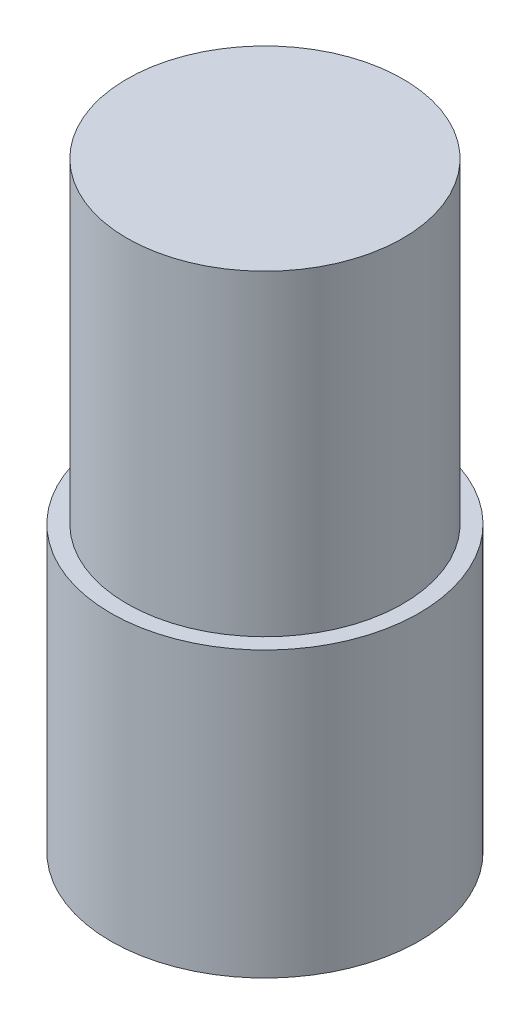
SolidWorks part; units mm, degrees
ref_plane "前视基准面" through (0, 0, 0) normal (0, 0, 1) x (1, 0, 0)
ref_plane "上视基准面" through (0, 0, 0) normal (0, 1, 0) x (1, 0, 0)
ref_plane "右视基准面" through (0, 0, 0) normal (1, 0, 0) x (0, 0, -1)
other "Configuration Table"
sketch "草图1" plane through (0, 0, 0) normal (0, 1, 0) x (1, 0, 0)
  circle A0 centre (0, 0) radius 19
extrude "凸台-拉伸1" add sketch "草图1" along normal blind 35
sketch "草图2" plane through (0, 35, 0) normal (0, 1, 0) x (1, 0, 0)
  circle A0 centre (0, 0) radius 17
extrude "凸台-拉伸2" add sketch "草图2" along normal blind 39
sketch "草图3" plane through (0, 0, 0) normal (0, -1, 0) x (1, 0, 0)
  circle A0 centre (0, 0) radius 3
  circle A1 centre (-12, 0) radius 3
extrude "凸台-拉伸3" add sketch "草图3" along normal blind 10
